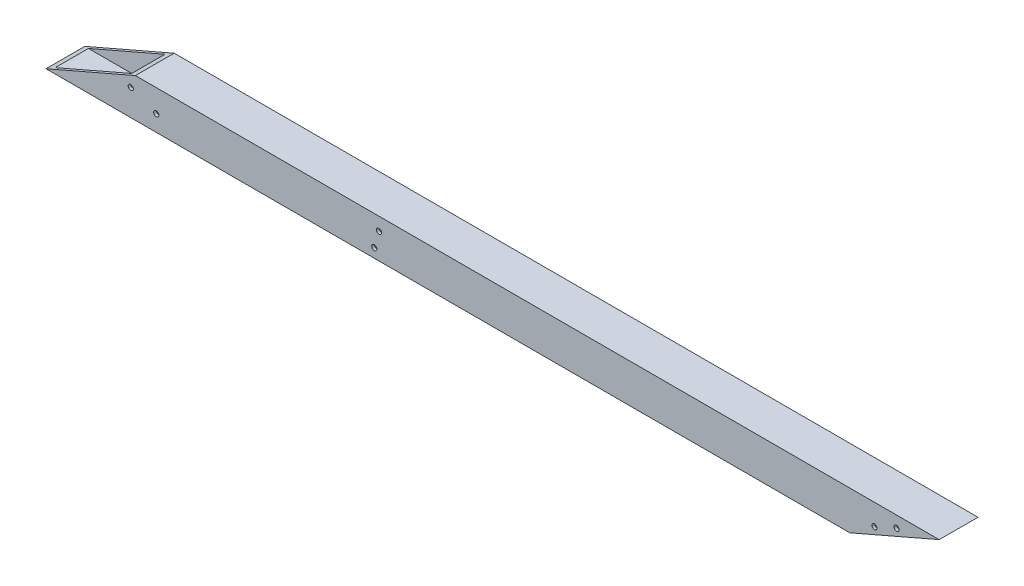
SolidWorks part; units mm, degrees
ref_plane "Front" through (0, 0, 0) normal (0, 0, 1) x (1, 0, 0)
ref_plane "Top" through (0, 0, 0) normal (0, 1, 0) x (1, 0, 0)
ref_plane "Right" through (0, 0, 0) normal (1, 0, 0) x (0, 0, -1)
sketch "Sketch1" plane through (0, 0, 0) normal (1, 0, 0) x (0, 0, -1)
  line L1 (0, 0) -> (50.8, 0)
  line L2 (0, 0) -> (0, 50.8)
  line L3 (0, 50.8) -> (50.8, 50.8)
  line L4 (50.8, 0) -> (50.8, 50.8)
  line L5 (3.6576, 47.1424) -> (47.1424, 47.1424)
  line L6 (3.6576, 47.1424) -> (3.6576, 3.6576)
  line L7 (3.6576, 3.6576) -> (47.1424, 3.6576)
  line L8 (47.1424, 47.1424) -> (47.1424, 3.6576)
  dimension "D1" = 50.8
  dimension "D2" = 50.8
  dimension "D3" = 3.6576
  dimension "D4" = 3.6576
  dimension "D5" = 3.6576
  dimension "D6" = 3.6576
extrude "Extrude1" add sketch "Sketch1" along normal blind 3048
sketch "Sketch4" plane through (0, 0, -50.8) normal (0, 0, -1) x (-1, 0, 0)
  line L2 (-1878.1514, 50.8) -> (106.6751, 50.8)
  line L3 (-1878.1514, 50.8) -> (-1878.1514, -133.697)
  line L4 (-3048, 25.4) -> (-1878.1514, 25.4) construction
  line L5 (-3048, 0) -> (-3048, 50.8) construction
  line L9 (-1878.1514, -133.697) -> (106.6751, -133.697)
  line L10 (106.6751, 50.8) -> (106.6751, -133.697)
  dimension "D3" = 1169.8486
extrude "Cut-Extrude1" cut sketch "Sketch4" against normal through all
sketch "Sketch5" plane through (0, 0, 0) normal (0, 0, 1) x (1, 0, 0)
  circle A0 centre (2992.1225, 35.8556) radius 3.3731
  circle A1 centre (3030.7426, 30.3761) radius 3.3731
  circle A2 centre (2308.1073, 12.0605) radius 3.3731
  circle A3 centre (2314.3273, 33.6323) radius 3.3731
  circle A4 centre (2963.0833, 23.0189) radius 3.3731
  dimension "D1" = 6.7462
  dimension "D2" = 6.7462
extrude "Cut-Extrude2" cut sketch "Sketch5" against normal through all
sketch "Sketch6" plane through (0, 0, -50.8) normal (0, 0, -1) x (-1, 0, 0)
  line L0 (-1878.1514, 0) -> (-2090.022, 91.9421)
  line L1 (-3048, 50.8) -> (-2907.6026, -10.126)
  line L3 (-1862.2569, 112.2023) -> (-2045.9855, 193.4192)
  line L4 (-2045.9855, 193.4192) -> (-2090.022, 91.9421)
  line L5 (-3048, 50.8) -> (-3123.6476, -123.5218)
  line L6 (-3123.6476, -123.5218) -> (-2983.2502, -184.4478)
  line L7 (-2983.2502, -184.4478) -> (-2907.6026, -10.126)
  line L8 (-1878.1514, 0) -> (-1832.531, 105.1273)
  line L9 (-1832.531, 105.1273) -> (-1862.2569, 112.2023)
  dimension "D1" = 419.1
extrude "Extrude2" cut sketch "Sketch6" against normal through all
sketch "Sketch7" plane through (0, 0, -50.8) normal (0, 0, -1) x (-1, 0, 0)
  circle A0 centre (-2022.5552, 21.1318) radius 3.3731
  circle A1 centre (-1989.1432, 34.321) radius 3.3731
extrude "Cut-Extrude3" cut sketch "Sketch7" against normal through all
